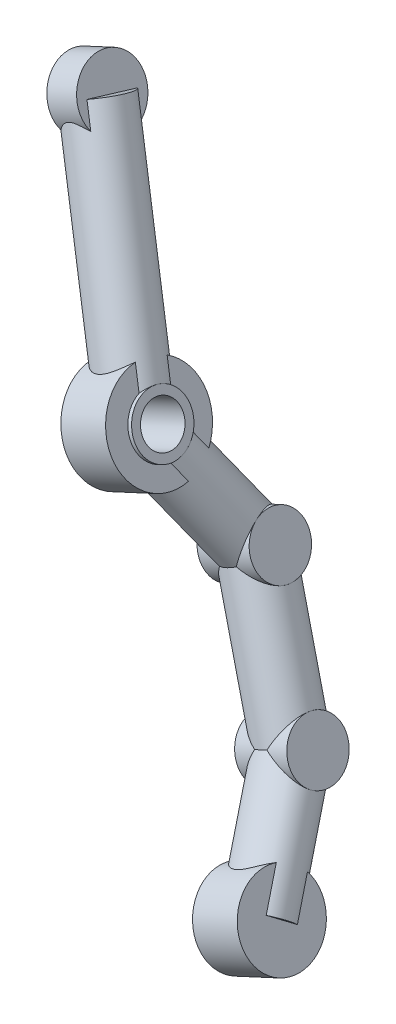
SolidWorks part; units mm, degrees
ref_plane "Alzado" through (0, 0, 0) normal (0, 0, 1) x (1, 0, 0)
ref_plane "Planta" through (0, 0, 0) normal (0, 1, 0) x (1, 0, 0)
ref_plane "Vista lateral" through (0, 0, 0) normal (1, 0, 0) x (0, 0, -1)
sketch3d "Sk_Brazo_1"
  line L0 (424.6109, 411.5791, -33) -> (436.398, 386.181, -26)
  dimension "D1" = 28.8617
sweep "Brazo_1" add path "Sk_Brazo_1" parameters "D3"=7
sketch3d "Sk_Brazo_2"
  line L0 (436.398, 386.181, -26) -> (442.7125, 372.5749, -34)
  dimension "D1" = 17
sweep "Brazo_2" add path "Sk_Brazo_2" parameters "D3"=7
sketch3d "Sk_Brazo_3"
  line L0 (442.7125, 372.5749, -34) -> (450.2899, 356.2475, -31)
  dimension "D1" = 18.2483
sweep "Brazo_3" add path "Sk_Brazo_3" parameters "D3"=7
sketch3d "Sk_Brazo_4"
  line L0 (450.2899, 356.2475, -31) -> (455.3416, 345.3626, -22)
  dimension "D1" = 15
sweep "Brazo_4" add path "Sk_Brazo_4" parameters "D3"=7
sketch3d "Sk_Brazo_codo_1"
  line L0 (433.2232, 384.7076, -26) -> (439.5728, 387.6544, -26)
  dimension "D1" = 7
sweep "Brazo_codo_1" add path "Sk_Brazo_codo_1" parameters "D3"=7
sketch3d "Sk_Brazo_codo_2"
  line L0 (439.5378, 371.1015, -34) -> (445.8873, 374.0483, -34)
  dimension "D1" = 7
sweep "Brazo_codo_2" add path "Sk_Brazo_codo_2" parameters "D3"=7
sketch3d "Sk_Brazo_codo_3"
  line L0 (447.1152, 354.7741, -31) -> (453.4647, 357.7209, -31)
  dimension "D1" = 7
sweep "Brazo_codo_3" add path "Sk_Brazo_codo_3" parameters "D3"=7
sketch3d "Sk_Ojo_pivote"
  line L0 (433.6768, 384.9181, -26) -> (439.1192, 387.4439, -26)
  dimension "D1" = 6
sweep "Ojo_pivote" add path "Sk_Ojo_pivote" parameters "D3"=12
sketch3d "Sk_Anclaje_cable"
  line L0 (422.7967, 410.7372, -33) -> (426.425, 412.4211, -33)
  dimension "D1" = 4
sweep "Anclaje_cable" add path "Sk_Anclaje_cable" parameters "D3"=8
sketch3d "Sk_Ojo_zapata"
  line L0 (452.6203, 344.0997, -22) -> (458.0628, 346.6255, -22)
  dimension "D1" = 6
sweep "Ojo_zapata" add path "Sk_Ojo_zapata" parameters "D3"=10
sketch3d "Sk_Taladro_pivote"
  line L0 (432.7697, 384.4971, -26) -> (440.0263, 387.8649, -26)
  dimension "D1" = 8
sweep "Taladro_pivote" cut path "Sk_Taladro_pivote" parameters "D3"=5
